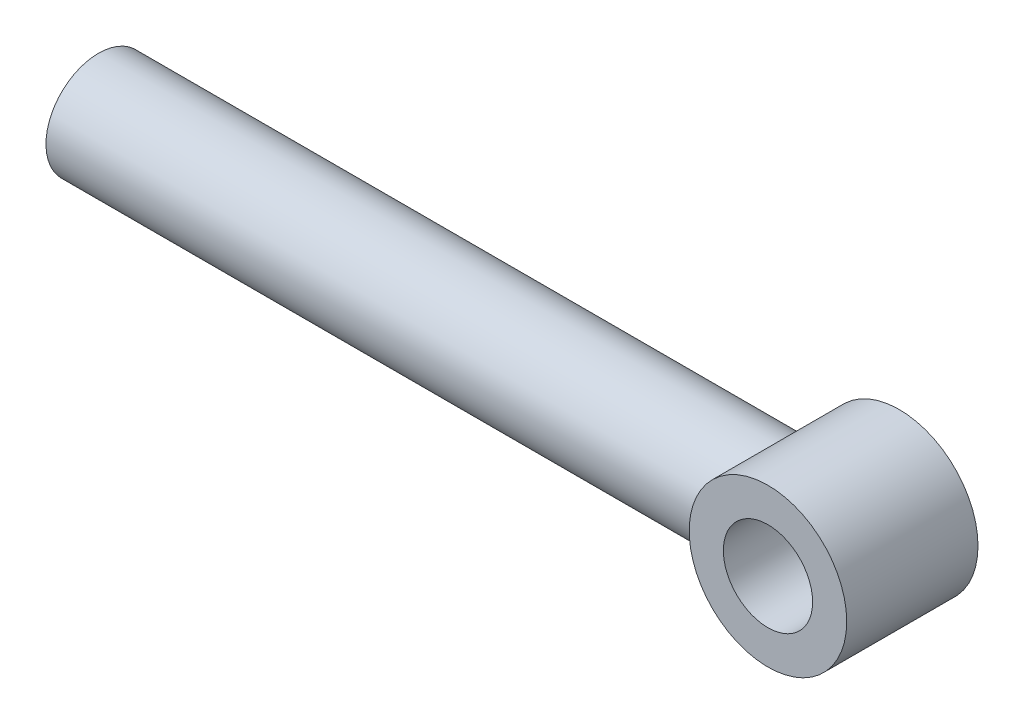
SolidWorks part; units mm, degrees
ref_plane "Plane1" through (0, 0, 0) normal (0, 0, 1) x (1, 0, 0)
ref_plane "Plane2" through (0, 0, 0) normal (0, 1, 0) x (1, 0, 0)
ref_plane "Plane3" through (0, 0, 0) normal (1, 0, 0) x (0, 0, -1)
sketch "Sketch1" plane through (0, 0, 0) normal (0, 0, 1) x (1, 0, 0)
  circle A0 centre (0, 0) radius 75
  dimension "D1" = 150
extrude "Base-Extrude" add sketch "Sketch1" along normal mid plane 125
sketch "Sketch2" plane through (0, 0, 0) normal (0, 0, 1) x (1, 0, 0)
  line L0 (0, 0) -> (-700, 0)
  line L1 (0, 0) -> (0, 50)
  line L2 (-700, 50) -> (0, 50)
  line L3 (-700, 50) -> (-700, 0)
  line L4 (0, 0) -> (-700, 0) construction
  dimension "D1" = 50
  dimension "D2" = 700
revolve "Boss-Revolve1" add sketch "Sketch2" angle 360 about L4
sketch "Sketch3" plane through (0, 0, 0) normal (0, 0, 1) x (1, 0, 0)
  circle A0 centre (0, 0) radius 42.5
  circle A1 centre (0, 0) radius 75 construction
  dimension "D1" = 85
extrude "Cut-Extrude1" cut sketch "Sketch3" against normal through all and the other way through all
ref_point "Point1"
